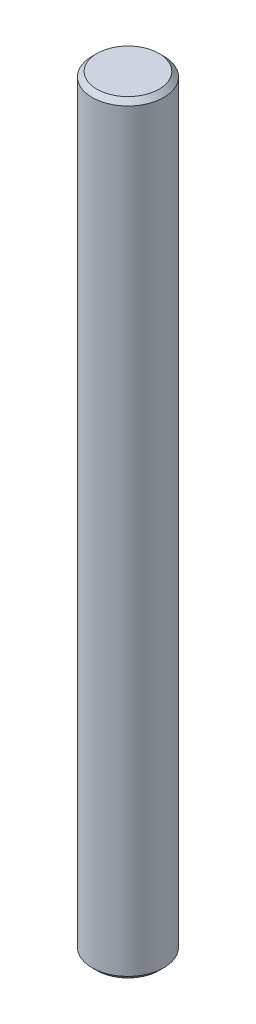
SolidWorks part; units mm, degrees
ref_plane "Спереди" through (0, 0, 0) normal (0, 0, 1) x (1, 0, 0)
ref_plane "Сверху" through (0, 0, 0) normal (0, 1, 0) x (1, 0, 0)
ref_plane "Справа" through (0, 0, 0) normal (1, 0, 0) x (0, 0, -1)
sketch "Эскиз2" plane through (0, 0, 0) normal (0, 1, 0) x (1, 0, 0)
  circle A0 centre (0, 0) radius 0.75
  dimension "D1" = 1.5
extrude "Бобышка-Вытянуть1" add sketch "Эскиз2" along normal mid plane 16
chamfer "Фаска1" distance 0.1 angle 45 2 edges at (0, -8, 0.75) (0, 8, 0.75)
